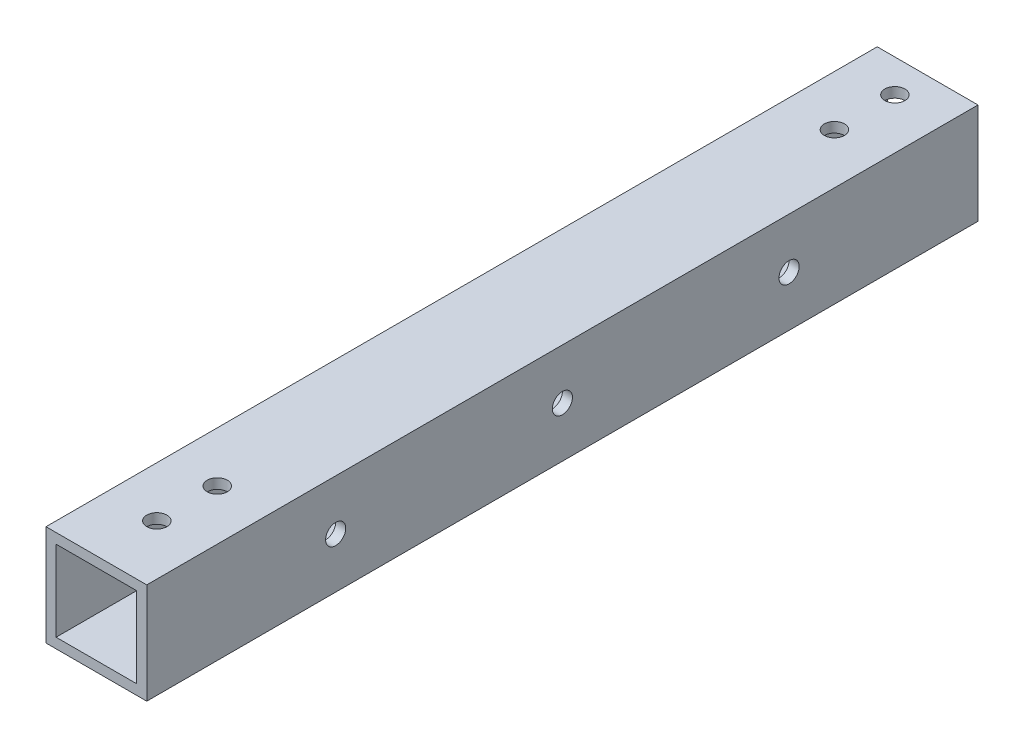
SolidWorks part; units mm, degrees
ref_plane "前视基准面" through (0, 0, 0) normal (0, 0, 1) x (1, 0, 0)
ref_plane "上视基准面" through (0, 0, 0) normal (0, 1, 0) x (1, 0, 0)
ref_plane "右视基准面" through (0, 0, 0) normal (1, 0, 0) x (0, 0, -1)
sketch "草图1" plane through (0, 0, 0) normal (0, 0, 1) x (1, 0, 0)
  line L0 (-8, 8) -> (8, 8)
  line L1 (-10, 10) -> (10, 10)
  line L2 (-10, 10) -> (-10, -10)
  line L3 (-10, -10) -> (10, -10)
  line L4 (10, 10) -> (10, -10)
  line L5 (-10, 10) -> (10, -10) construction
  line L6 (-10, -10) -> (10, 10) construction
  line L7 (8, 8) -> (8, -8)
  line L8 (-8, -8) -> (8, -8)
  line L9 (-8, 8) -> (-8, -8)
  point P0 (0, 0)
  dimension "D1" = 20
  dimension "D2" = 20
  dimension "D3" = 2
extrude "凸台-拉伸1" add sketch "草图1" along normal blind 165
hole_wizard "Ø4.0 (4) 直径孔2" positions "草图4" profile "草图5" hole size "Ø4.0" standard "GB"
sketch "草图4" plane through (0, 10, 0) normal (0, 1, 0) x (1, 0, 0)
  line L0 (10, 0) -> (-10, 0) construction
  line L1 (10, -165) -> (-10, -165) construction
  line L2 (-10, -165) -> (-10, 0) construction
  point P0 (0, -153)
  point P2 (0, -141)
  point P4 (0, -18.5)
  point P6 (0, -6.5)
  point P15 (0, 0)
  dimension "D1" = 12
  dimension "D2" = 6.5
  dimension "D3" = 12
  dimension "D4" = 12
  dimension "D5" = 10
sketch "草图5" plane through (0, 10, 153) normal (1, 0, 0) x (0, 0, 1)
  line L0 (0, 0) -> (0, 20)
  line L1 (0, 20) -> (2, 20)
  line L2 (2, 20) -> (2, 0)
  line L5 (2, 0) -> (0, 0)
  line L11 (0, -6.35) -> (0, 107.95) construction
  dimension "通孔孔直径" = 4
  dimension "通孔孔深度" = 20
hole_wizard "Ø4.0 (4) 直径孔3" positions "草图6" profile "草图7" hole size "Ø4.0" standard "GB"
sketch "草图6" plane through (-10, 0, 0) normal (-1, 0, 0) x (0, 0, 1)
  point P0 (37.5, 0)
  point P3 (82.5, 0)
  point P6 (127.5, 0)
sketch "草图7" plane through (-10, 0, 37.5) normal (0, 1, 0) x (0, 0, 1)
  line L0 (0, 0) -> (0, 20)
  line L1 (0, 20) -> (2, 20)
  line L2 (2, 20) -> (2, 0)
  line L5 (2, 0) -> (0, 0)
  line L11 (0, -6.35) -> (0, 107.95) construction
  dimension "通孔孔直径" = 4
  dimension "通孔孔深度" = 20
